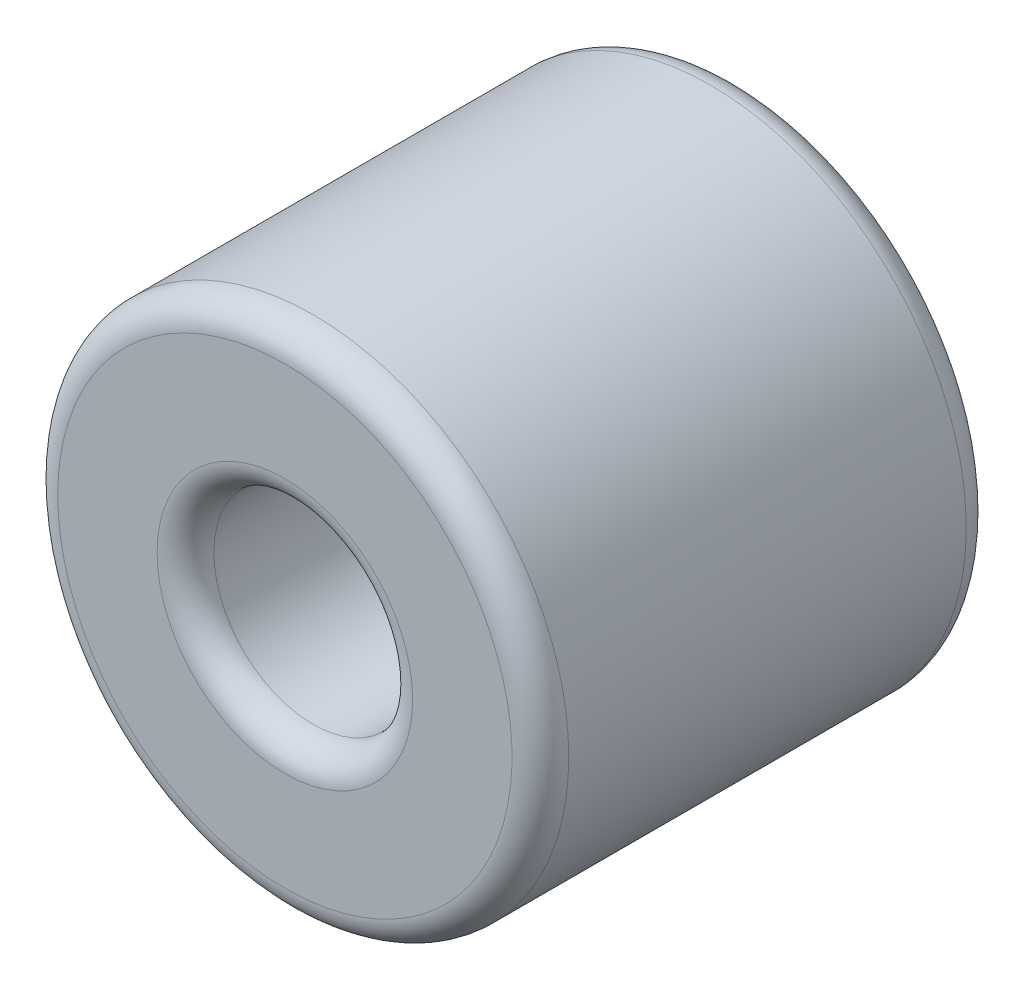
SolidWorks part; units mm, degrees
ref_plane "Спереди" through (0, 0, 0) normal (0, 0, 1) x (1, 0, 0)
ref_plane "Сверху" through (0, 0, 0) normal (0, 1, 0) x (1, 0, 0)
ref_plane "Справа" through (0, 0, 0) normal (1, 0, 0) x (0, 0, -1)
sketch "Эскиз1" plane through (0, 0, 0) normal (1, 0, 0) x (0, 0, -1)
  line L0 (-4, 0) -> (4, 0) construction
  line L1 (-4, 1.75) -> (4, 1.75)
  line L2 (4, 1.75) -> (4, 4.5)
  line L3 (4, 4.5) -> (-4, 4.5)
  line L4 (-4, 4.5) -> (-4, 1.75)
  dimension "D1" = 9
  dimension "D2" = 3.5
  dimension "D3" = 8
revolve "Повернуть1" add sketch "Эскиз1" angle 360 about L0
fillet "Скругление1" radius 0.5 4 edges at (4.5, 0, -4) (4.5, 0, 4) (1.75, 0, 4) (1.75, 0, -4)
